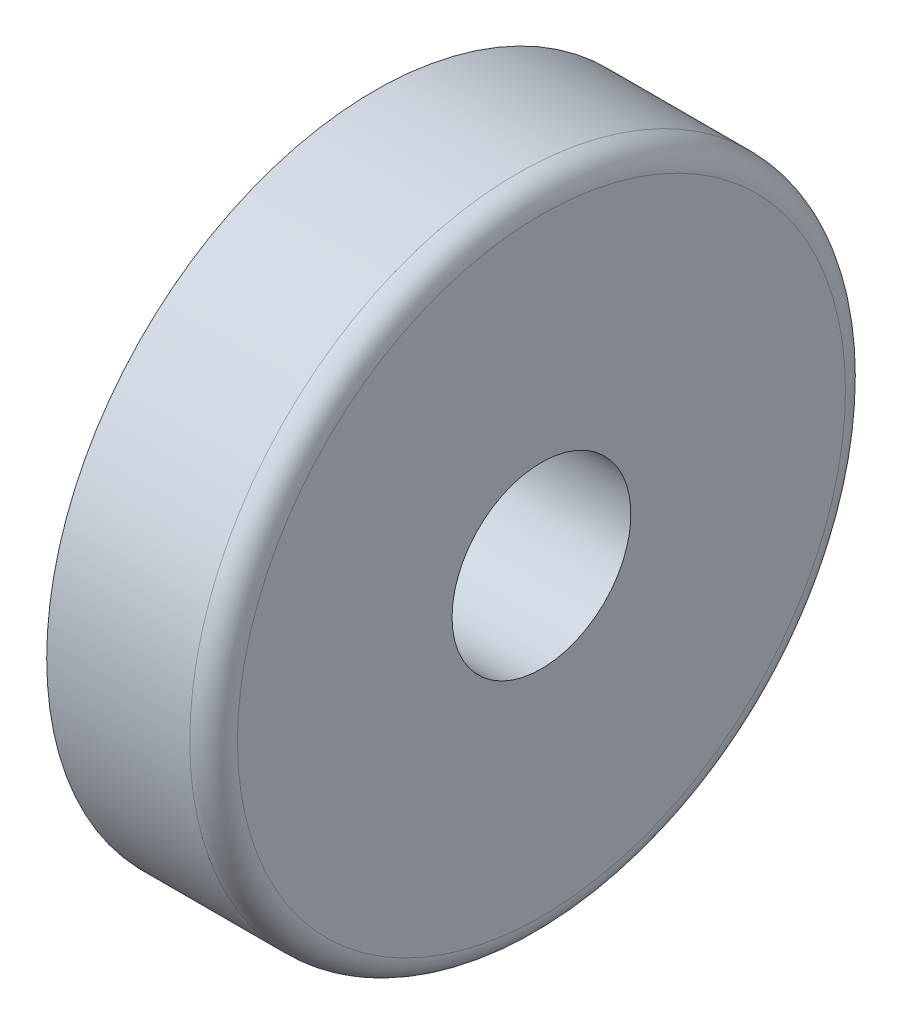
SolidWorks part; units mm, degrees
ref_plane "Alzado" through (0, 0, 0) normal (0, 0, 1) x (1, 0, 0)
ref_plane "Planta" through (0, 0, 0) normal (0, 1, 0) x (1, 0, 0)
ref_plane "Vista lateral" through (0, 0, 0) normal (1, 0, 0) x (0, 0, -1)
sketch "Croquis1" plane through (0, 0, 0) normal (0, 1, 0) x (1, 0, 0)
  line L0 (-6.5625, 0) -> (6.5625, 0) construction
  line L2 (-2.8, 3) -> (2.8, 3)
  line L3 (-2.8, 3) -> (-2.8, 11)
  line L4 (-2.8, 11) -> (2, 11)
  line L5 (2.8, 3) -> (2.8, 10.2)
  arc A0 (2.8, 10.2) -> (2, 11) centre (2, 10.2) ccw
  point P4 (0, 0)
  dimension "D5" = 0.8
  dimension "D1" = 5.6
  dimension "D2" = 2.8
  dimension "D3" = 22
  dimension "D4" = 6
revolve "Revolución1" add sketch "Croquis1" angle 360 about L0
